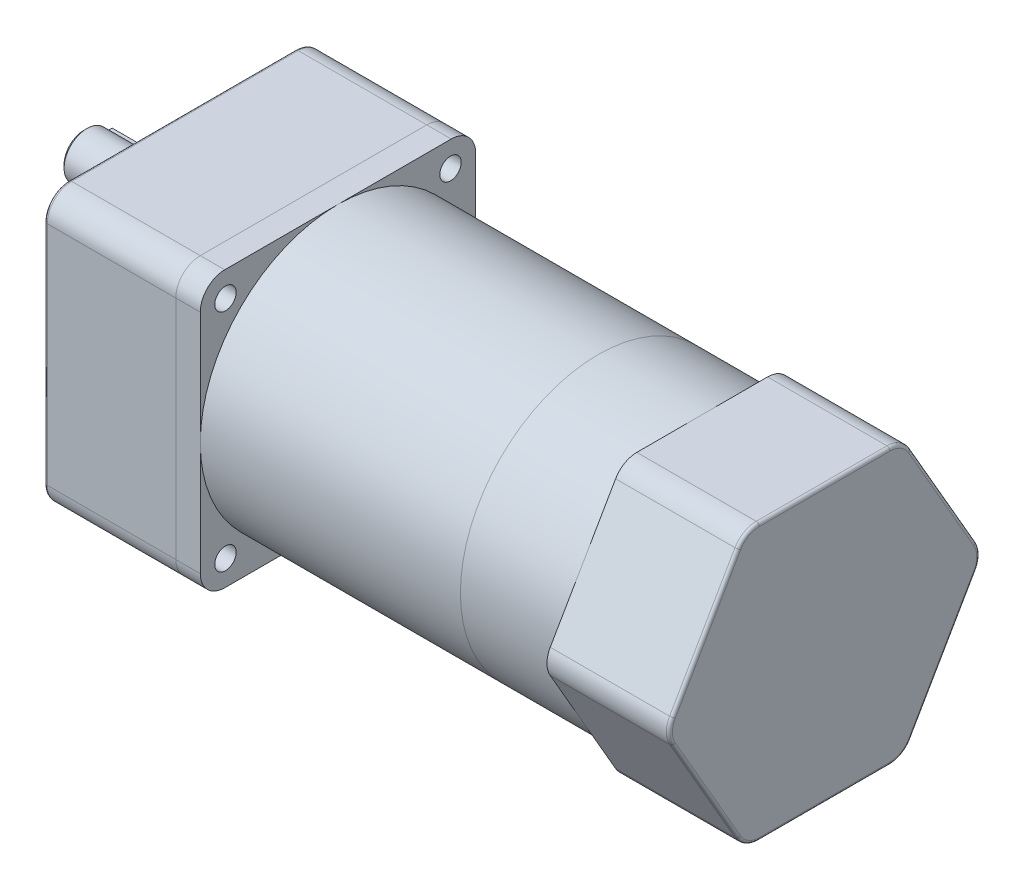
SolidWorks part; units mm, degrees
ref_plane "前视基准面" through (0, 0, 0) normal (0, 0, 1) x (1, 0, 0)
ref_plane "上视基准面" through (0, 0, 0) normal (0, 1, 0) x (1, 0, 0)
ref_plane "右视基准面" through (0, 0, 0) normal (1, 0, 0) x (0, 0, -1)
sketch "草图1" plane through (0, 0, 0) normal (1, 0, 0) x (0, 0, -1)
  line L1 (-37, -45) -> (37, -45)
  line L2 (-45, -37) -> (-45, 37)
  line L3 (-37, 45) -> (37, 45)
  line L4 (45, -37) -> (45, 37)
  line L5 (-45, -45) -> (45, 45) construction
  line L6 (-45, 45) -> (45, -45) construction
  arc A0 (-37, -45) -> (-45, -37) centre (-37, -37) cw
  arc A1 (-45, 37) -> (-37, 45) centre (-37, 37) cw
  arc A2 (37, 45) -> (45, 37) centre (37, 37) cw
  arc A3 (37, -45) -> (45, -37) centre (37, -37) ccw
  point P0 (0, 0)
  dimension "D1" = 8
extrude "凸台-拉伸1" add sketch "草图1" along normal blind 43
sketch "草图2" plane through (43, 0, 0) normal (1, 0, 0) x (0, 0, -1)
  line L0 (37, 45) -> (-37, 45) construction
  line L1 (-37, -45) -> (37, -45)
  line L2 (-45, -37) -> (-45, 37)
  line L3 (-37, 45) -> (37, 45)
  line L4 (45, -37) -> (45, 37)
  line L5 (-45, -45) -> (45, 45) construction
  line L6 (-45, 45) -> (45, -45) construction
  arc A0 (37, 45) -> (45, 37) centre (37, 37) cw
  arc A1 (37, -45) -> (45, -37) centre (37, -37) ccw
  arc A2 (-37, -45) -> (-45, -37) centre (-37, -37) cw
  arc A3 (-45, 37) -> (-37, 45) centre (-37, 37) cw
  point P0 (0, 0)
  dimension "D1" = 8
extrude "凸台-拉伸2" add sketch "草图2" along normal blind 8 separate body
sketch "草图3" plane through (51, 0, 0) normal (1, 0, 0) x (0, 0, -1)
  circle A0 centre (0, 0) radius 45
extrude "凸台-拉伸3" add sketch "草图3" along normal blind 85 separate body
sketch "草图4" plane through (136, 0, 0) normal (1, 0, 0) x (0, 0, -1)
  circle A0 centre (0, 0) radius 45
extrude "凸台-拉伸4" add sketch "草图4" along normal blind 34 separate body
sketch "草图5" plane through (170, 0, 0) normal (1, 0, 0) x (0, 0, -1)
  line L1 (21.362, 45) -> (-21.362, 45)
  line L2 (-28.2902, 41) -> (-49.6521, 4)
  line L3 (-49.6521, -4) -> (-28.2902, -41)
  line L4 (-21.362, -45) -> (21.362, -45)
  line L5 (28.2902, -41) -> (49.6521, -4)
  line L6 (49.6521, 4) -> (28.2902, 41)
  circle A0 centre (0, 0) radius 45 construction
  arc A1 (-49.6521, 4) -> (-49.6521, -4) centre (-42.7239, 0) ccw
  arc A2 (-28.2902, -41) -> (-21.362, -45) centre (-21.362, -37) ccw
  arc A3 (21.362, -45) -> (28.2902, -41) centre (21.362, -37) ccw
  arc A4 (49.6521, -4) -> (49.6521, 4) centre (42.7239, 0) ccw
  arc A5 (21.362, 45) -> (28.2902, 41) centre (21.362, 37) cw
  arc A6 (-21.362, 45) -> (-28.2902, 41) centre (-21.362, 37) ccw
  dimension "D1" = 8
extrude "凸台-拉伸5" add sketch "草图5" along normal blind 40 separate body
fillet "圆角1" radius 1 12 edges at (210, 22.5, 38.9711) (210, 43.9282, 25.362) (210, 45, 0) (210, 43.9282, -25.362) (210, 22.5, -38.9711) (210, 0, -50.7239) (210, -22.5, -38.9711) (210, -43.9282, -25.362) (210, -45, 0) (210, -43.9282, 25.362) (210, -22.5, 38.9711) (210, 0, 50.7239)
fillet "圆角2" radius 1 8 edges at (0, -45, 0) (0, -42.6569, -42.6569) (0, 0, -45) (0, 42.6569, -42.6569) (0, 45, 0) (0, 42.6569, 42.6569) (0, 0, 45) (0, -42.6569, 42.6569)
sketch "草图6" plane through (0, 0, 0) normal (-1, 0, 0) x (0, 0, 1)
  point P19 (36.7696, 36.7696)
  point P20 (36.7696, -36.7696)
  point P21 (-36.7696, -36.7696)
  point P22 (-36.7696, 36.7696)
hole_wizard "M6 螺纹孔1" positions "3D草图1" profile "草图7" tap size "M6" standard "GB"
sketch3d "3D草图1"
  point P0 (0, 36.7696, 36.7696)
  point P3 (0, -36.7696, 36.7696)
  point P6 (0, 36.7696, -36.7696)
  point P9 (0, -36.7696, -36.7696)
sketch "草图7" plane through (0, 36.7696, 36.7696) normal (0, 1, 0) x (0, 0, 1)
  line L0 (0, 0) -> (0, 18.5022)
  line L1 (0, 18.5022) -> (2.5, 17)
  line L2 (2.5, 17) -> (2.5, 0)
  line L5 (2.5, 0) -> (0, 0)
  line L10 (0, 18.5022) -> (-2.5, 17) construction
  line L11 (0, -6.35) -> (0, 107.95) construction
  dimension "螺纹孔钻头直径" = 5
  dimension "螺纹孔钻头深度" = 17
  dimension "导头角度" = 118
sketch "草图8" plane through (51, 0, 0) normal (1, 0, 0) x (0, 0, -1)
  line L1 (42.6569, -42.6569) -> (42.6569, 42.6569)
  arc A2 (37, -45) -> (45, -37) centre (37, -37) ccw construction
  arc A3 (45, 37) -> (37, 45) centre (37, 37) ccw construction
  circle A5 centre (-36.7696, 36.7696) radius 3.5
  circle A6 centre (36.7696, 36.7696) radius 3.5
  circle A7 centre (36.7696, -36.7696) radius 3.5
  circle A8 centre (-36.7696, -36.7696) radius 3.5
extrude "切除-拉伸1" cut sketch "草图8" against normal blind 26 contours A5 | A6 | A7 | A8
sketch "草图9" plane through (0, 0, 0) normal (-1, 0, 0) x (0, 0, 1)
  circle A0 centre (0, 18) radius 16
extrude "凸台-拉伸6" add sketch "草图9" along normal blind 3
fillet "圆角3" radius 0.5 1 edges at (-3, 18, 16)
sketch "草图10" plane through (0, 0, 0) normal (-1, 0, 0) x (0, 0, 1)
  circle A0 centre (0, 0) radius 41.4
extrude "切除-拉伸2" cut sketch "草图10" against normal blind 0.5
fillet "圆角4" radius 0.5 1 edges at (0, 0, 41.4)
sketch "草图11" plane through (-3, 0, 0) normal (-1, 0, 0) x (0, 0, 1)
  circle A0 centre (0, 18) radius 7.5
extrude "凸台-拉伸7" add sketch "草图11" along normal blind 29 separate body
ref_plane "基准面1" through (0, 0, -7.5) normal (0, 0, 1) x (1, 0, 0)
sketch "草图12" plane through (0, 0, -7.5) normal (0, 0, 1) x (1, 0, 0)
  line L1 (-32, 25.5) -> (-32, 10.5) construction
  line L2 (-9.5, 20.5) -> (-32, 20.5)
  line L3 (-32, 20.5) -> (-32, 15.5)
  line L4 (-32, 15.5) -> (-9.5, 15.5)
  arc A0 (-9.5, 15.5) -> (-9.5, 20.5) centre (-9.5, 18) ccw
extrude "切除-拉伸4" cut sketch "草图12" along normal blind 3
sketch "草图13" plane through (0, 0, -4.5) normal (0, 0, -1) x (-1, 0, 0)
  line L0 (9.5, 20.5) -> (32, 20.5)
  line L1 (32, 20.5) -> (32, 15.5)
  line L2 (32, 15.5) -> (9.5, 15.5)
  arc A0 (9.5, 20.5) -> (9.5, 15.5) centre (9.5, 18) ccw
extrude "凸台-拉伸8" add sketch "草图13" along normal blind 5 separate body
chamfer "倒角1" distance 0.3 angle 45 4 edges at (-7, 18, -9.5) (-20.75, 15.5, -9.5) (-32, 18, -9.5) (-20.75, 20.5, -9.5)
chamfer "倒角2" distance 1 angle 45 1 edges at (-32, 18, 7.5)
